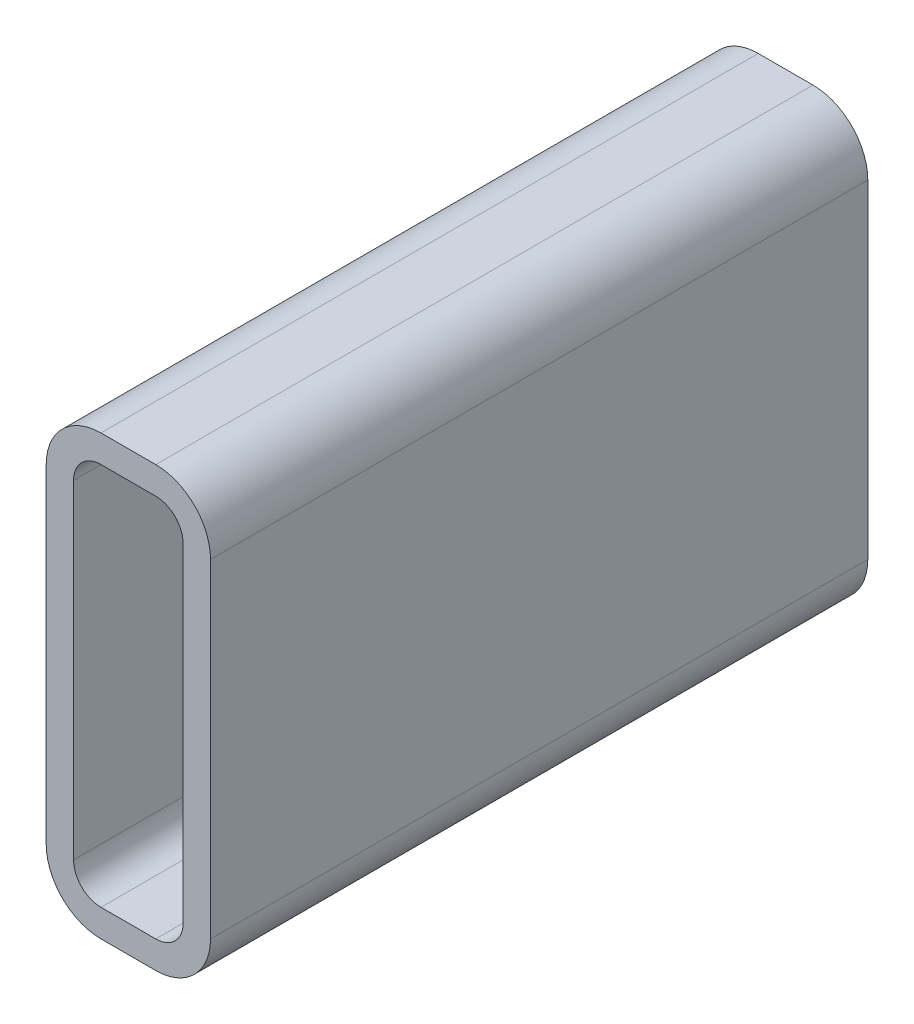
SolidWorks part; units mm, degrees
ref_plane "Front Plane" through (0, 0, 0) normal (0, 0, 1) x (1, 0, 0)
ref_plane "Top Plane" through (0, 0, 0) normal (0, 1, 0) x (1, 0, 0)
ref_plane "Right Plane" through (0, 0, 0) normal (1, 0, 0) x (0, 0, -1)
sketch "Sketch1" plane through (0, 0, 0) normal (0, 0, 1) x (1, 0, 0)
sketch_block_instance "HSS8x3x0.500-1"
sketch_block "HSS8x3x0.500"
extrude "Boss-Extrude1" add sketch "Sketch1" along normal blind 304.8
